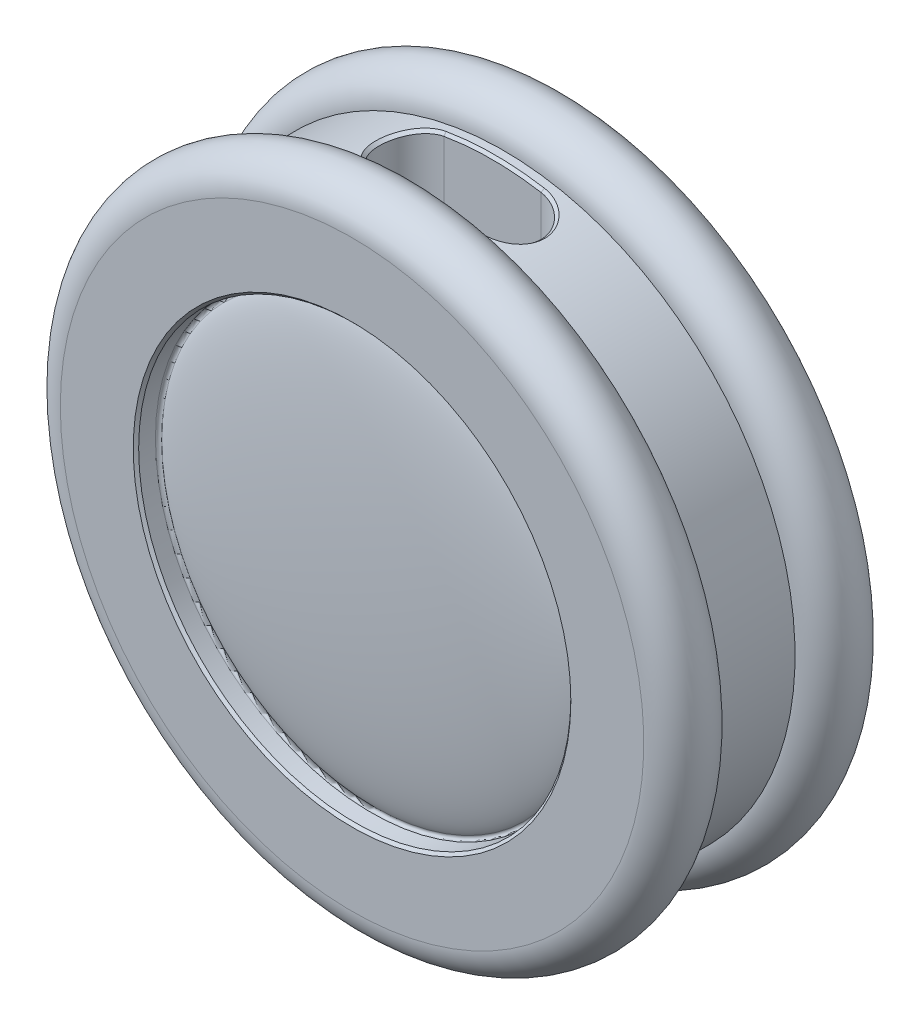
SolidWorks part; units mm, degrees
ref_plane "Спереди" through (0, 0, 0) normal (0, 0, 1) x (1, 0, 0)
ref_plane "Сверху" through (0, 0, 0) normal (0, 1, 0) x (1, 0, 0)
ref_plane "Справа" through (0, 0, 0) normal (1, 0, 0) x (0, 0, -1)
sketch "Эскиз1" plane through (0, 0, 0) normal (0, 1, 0) x (1, 0, 0)
  line L0 (0, 20) -> (0, -20)
  line L1 (-54, -20) -> (0, -20) construction
  line L2 (-54, 20) -> (0, 20) construction
  line L3 (-54, -8) -> (-54, 8)
  line L4 (-54, 20) -> (-40, 20)
  line L5 (-40, 20) -> (-40, 15)
  line L6 (-54, -20) -> (-40, -20)
  line L7 (-40, -20) -> (-40, -15)
  arc A0 (-54, -8) -> (-54, -20) centre (-54, -14) ccw
  arc A1 (-54, 20) -> (-54, 8) centre (-54, 14) ccw
  ellipse E0 centre (0, -15) end of major axis (40, -15) minor radius 5 (-40, -15) -> (0, -20) ccw
  ellipse E1 centre (0, 15) end of major axis (-40, 15) minor radius 5 (0, 20) -> (-40, 15) ccw
  dimension "D2" = 12
  dimension "D1" = 40
  dimension "D3" = 54
  dimension "D4" = 40
  dimension "D5" = 5
revolve "Повернуть1" add sketch "Эскиз1" angle 360 about L0
sketch "Эскиз2" plane through (0, 0, 0) normal (0, 1, 0) x (1, 0, 0)
  line L1 (9, 6) -> (-9, 6)
  line L2 (9, 6) -> (9, -6) construction
  line L3 (9, -6) -> (-9, -6)
  line L4 (-9, 6) -> (-9, -6) construction
  line L5 (9, 6) -> (-9, -6) construction
  line L6 (9, -6) -> (-9, 6) construction
  arc A0 (-9, 6) -> (-9, -6) centre (-9, 0) ccw
  arc A1 (9, -6) -> (9, 6) centre (9, 0) ccw
  point P0 (0, 0)
  dimension "D1" = 12
  dimension "D2" = 18
extrude "Вырез-Вытянуть1" cut sketch "Эскиз2" against normal mid plane 110
chamfer "Фаска1" distance 0.5 angle 45 10 edges at (0, -54, 6) (0, 54, 6) (14.9469, -51.8902, 0.7966) (14.9469, 51.8902, -0.7966) (-14.9469, -51.8902, -0.7966) (-14.9469, 51.8902, 0.7966) (0, -54, -6) (0, 54, -6) (-40, 0, -20) (-40, 0, 20)
fillet "Скругление1" radius 0.5 2 edges at (-40, 0, -15) (-40, 0, 15)
